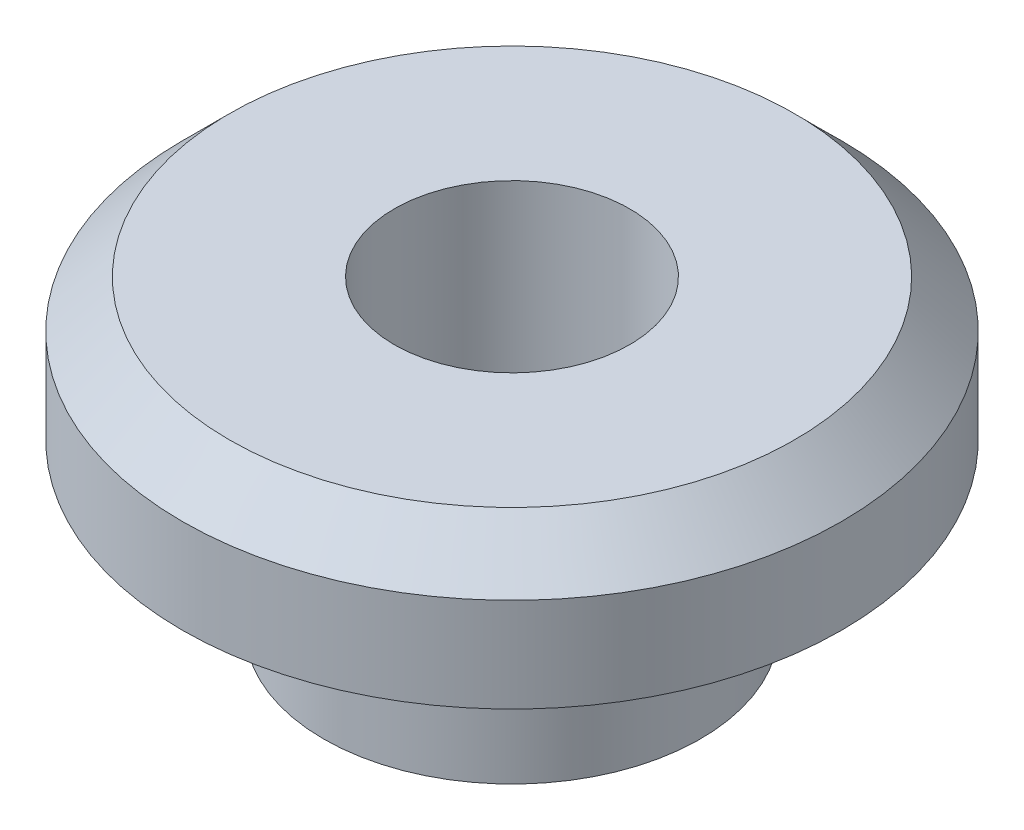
SolidWorks part; units mm, degrees
ref_plane "Front Plane" through (0, 0, 0) normal (0, 0, 1) x (1, 0, 0)
ref_plane "Top Plane" through (0, 0, 0) normal (0, 1, 0) x (1, 0, 0)
ref_plane "Right Plane" through (0, 0, 0) normal (1, 0, 0) x (0, 0, -1)
sketch "Sketch1" plane through (0, 0, 0) normal (0, 1, 0) x (1, 0, 0)
  circle A0 centre (0, 0) radius 4
  dimension "D1" = 8
extrude "Extrude1" add sketch "Sketch1" along normal blind 3.5
sketch "Sketch2" plane through (0, 3.5, 0) normal (0, 1, 0) x (1, 0, 0)
  circle A0 centre (0, 0) radius 7
  dimension "D1" = 14
extrude "Extrude2" add sketch "Sketch2" along normal blind 3
sketch "Sketch3" plane through (0, 6.5, 0) normal (0, 1, 0) x (1, 0, 0)
  circle A0 centre (0, 0) radius 2.5
  dimension "D1" = 5
extrude "Extrude3" cut sketch "Sketch3" against normal through all
chamfer "Chamfer1" distance 1 angle 45 1 edges at (0, 6.5, 7)
